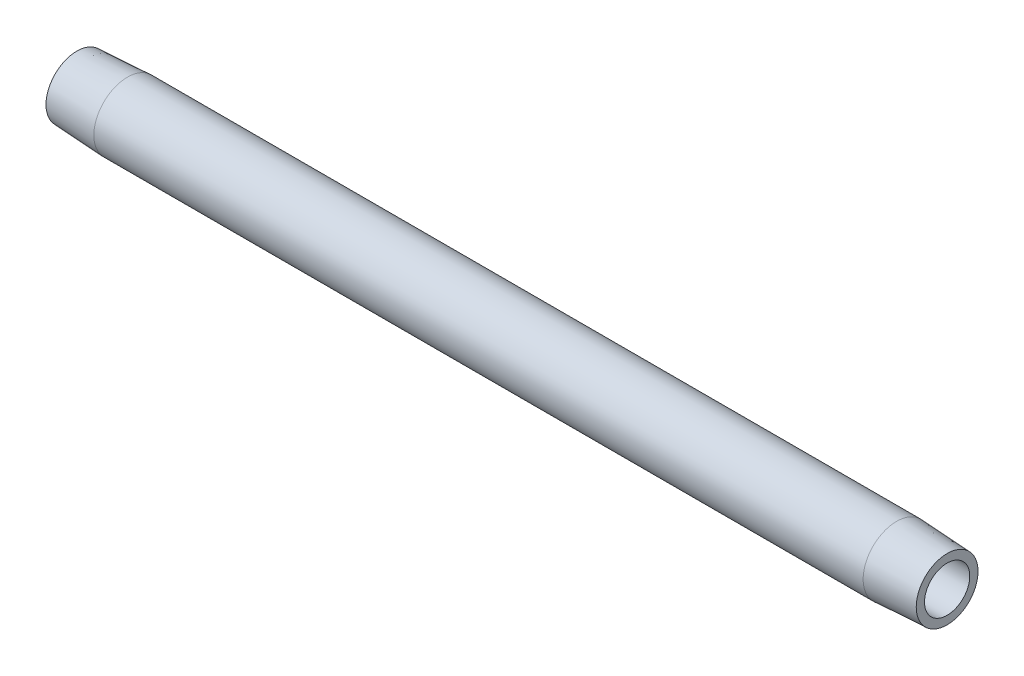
SolidWorks part; units mm, degrees
ref_plane "Front Plane" through (0, 0, 0) normal (0, 0, 1) x (1, 0, 0)
ref_plane "Top Plane" through (0, 0, 0) normal (0, 1, 0) x (1, 0, 0)
ref_plane "Right Plane" through (0, 0, 0) normal (1, 0, 0) x (0, 0, -1)
sketch "Sketch1" plane through (0, 0, 0) normal (0, 1, 0) x (1, 0, 0)
  line L6 (177.8, 4.6228) -> (0, 4.6228)
  line L7 (10.3124, 6.858) -> (0, 6.3175)
  line L8 (0, 6.3175) -> (0, 4.6228)
  line L9 (167.4876, 6.858) -> (10.3124, 6.858)
  line L10 (177.8, 6.3175) -> (167.4876, 6.858)
  line L11 (177.8, 4.6228) -> (177.8, 6.3175)
  line L12 (-6.376, 0) -> (49993.624, 0) construction
  dimension "D1" = 9.2456
  dimension "D2" = 13.716
  dimension "D3" = 3
  dimension "D4" = 3
  dimension "D5" = 177.8
  dimension "D6" = 10.3124
  dimension "D7" = 10.3124
revolve "Revolve1" add sketch "Sketch1" angle 360 about L12
